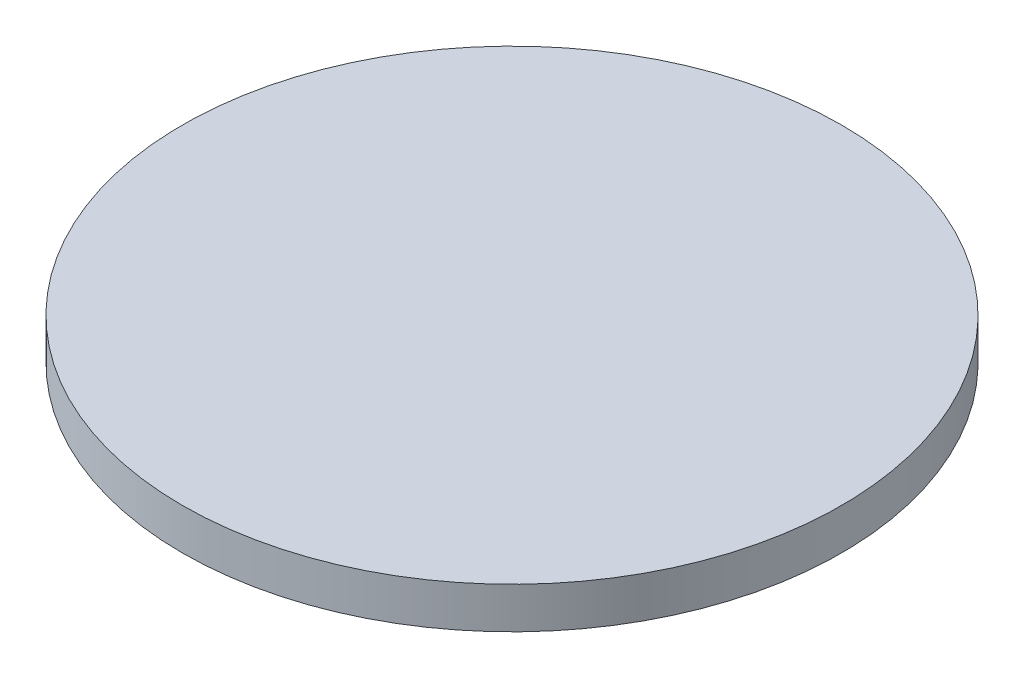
SolidWorks part; units mm, degrees
ref_plane "Front Plane" through (0, 0, 0) normal (0, 0, 1) x (1, 0, 0)
ref_plane "Top Plane" through (0, 0, 0) normal (0, 1, 0) x (1, 0, 0)
ref_plane "Right Plane" through (0, 0, 0) normal (1, 0, 0) x (0, 0, -1)
sketch "Sketch1" plane through (0, 0, 0) normal (0, 1, 0) x (1, 0, 0)
  circle A0 centre (0, 0) radius 50.8
  dimension "D1" = 101.6
extrude "Boss-Extrude1" add sketch "Sketch1" along normal blind 6.35
